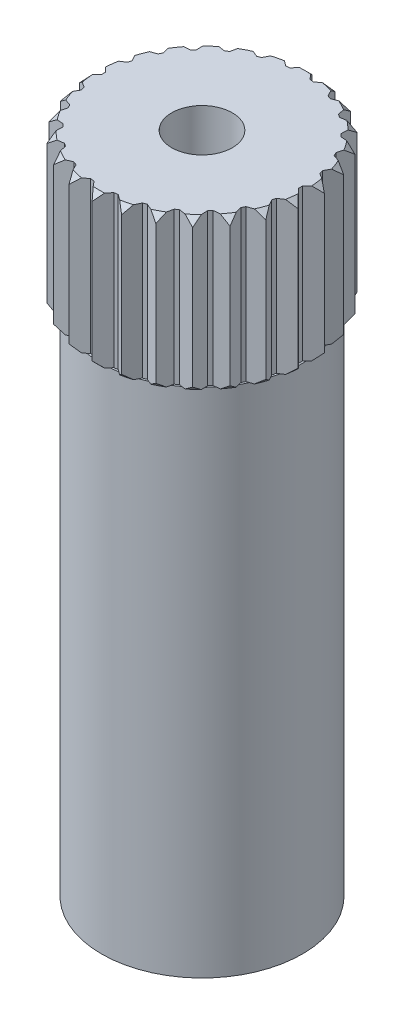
SolidWorks part; units mm, degrees
ref_plane "Front Plane" through (0, 0, 0) normal (0, 0, 1) x (1, 0, 0)
ref_plane "Top Plane" through (0, 0, 0) normal (0, 1, 0) x (1, 0, 0)
ref_plane "Right Plane" through (0, 0, 0) normal (1, 0, 0) x (0, 0, -1)
sketch "Sketch12" plane through (0, 0, 0) normal (0, 1, 0) x (1, 0, 0)
  circle A0 centre (0, 0) radius 2.9
  dimension "D1" = 5.8
extrude "Boss-Extrude4" add sketch "Sketch12" along normal blind 13.5 separate body
sketch "Sketch13" plane through (0, 13.5, 0) normal (0, 1, 0) x (1, 0, 0)
  circle A2 centre (0, 0) radius 2.6
  circle A3 centre (0, 0) radius 2.9 construction
  dimension "D1" = 0.3
extrude "Boss-Extrude5" add sketch "Sketch13" along normal blind 4
sketch "Sketch14" plane through (0, 17.5, 0) normal (0, 1, 0) x (1, 0, 0)
  line L0 (0, 2.6) -> (0, 2.9) construction
  line L1 (0, 2.9) -> (-0.2629, 2.5867)
  line L2 (0, 2.9) -> (0.2629, 2.5867)
  line L3 (-0.2629, 2.5867) -> (0.2629, 2.5867) construction
  circle A0 centre (0, 0) radius 2.9 construction
  circle A1 centre (0, 0) radius 2.6
  arc A2 (0.2629, 2.5867) -> (-0.2629, 2.5867) centre (0, 0) ccw
  dimension "D2" = 80
  dimension "D3" = 0.5258
  dimension "D4" = 0.3
  dimension "D1" = 0
extrude "Boss-Extrude6" add sketch "Sketch14" against normal up to body separate body
pattern_circular "CirPattern1" count 26 over 360 about axis through (0, 0, 0) along (0, 1, 0) of "Boss-Extrude6"
sketch "Sketch15" plane through (0, 0, 0) normal (1, 0, 0) x (0, 0, -1)
  line L0 (2.9, 17.3232) -> (2.9, 17.5)
  line L1 (2.9, 13.5) -> (2.9, 17.5) construction
  line L2 (2.9, 17.5) -> (2.7232, 17.5)
  line L3 (2.1682, 17.5) -> (2.5678, 17.5) construction
  line L4 (2.7232, 17.5) -> (2.9, 17.3232)
  dimension "D1" = 45
  dimension "D2" = 0.25
revolve "Cut-Revolve1" cut sketch "Sketch15" angle 360 about axis through (0, 17.5, 0) along (0, -1, 0)
sketch "Sketch16" plane through (0, 17.5, 0) normal (0, 1, 0) x (1, 0, 0)
  circle A0 centre (0, 0) radius 0.8
  dimension "D1" = 1.6
extrude "Cut-Extrude1" cut sketch "Sketch16" against normal blind 4
ref_plane "Plane1" through (-0.3638, 13.5, -2.5744) normal (-0.9902, 0, 0.1399) x (0.1399, 0, 0.9902)
sketch "Sketch17" plane through (0, 0, 0) normal (0, 0, 1) x (1, 0, 0)
  line L0 (2.9, 0) -> (2.65, 0)
  line L1 (-2.9, 0) -> (2.9, 0) construction
  line L2 (2.65, 0) -> (2.65, 13.5)
  line L3 (2.65, 13.5) -> (2.9, 13.5)
  line L4 (2.9, 13.5) -> (2.9, 0)
  line L5 (0, 0) -> (2.65, 0) construction
  line L6 (2.7115, 13.5) -> (2.3254, 13.5) construction
  dimension "D1" = 0.25
  dimension "D2" = 2.65
  dimension "D3" = 2.9
revolve "Cut-Revolve2" cut sketch "Sketch17" angle 360 about axis through (0, 13.5, 0) along (0, -1, 0)
ref_plane "Plane2" through (0, 15.5, 0) normal (0, 1, 0) x (1, 0, 0)
mirror "Mirror1" about plane through (0, 15.5, 0) normal (0, 1, 0) of "Cut-Revolve1"
